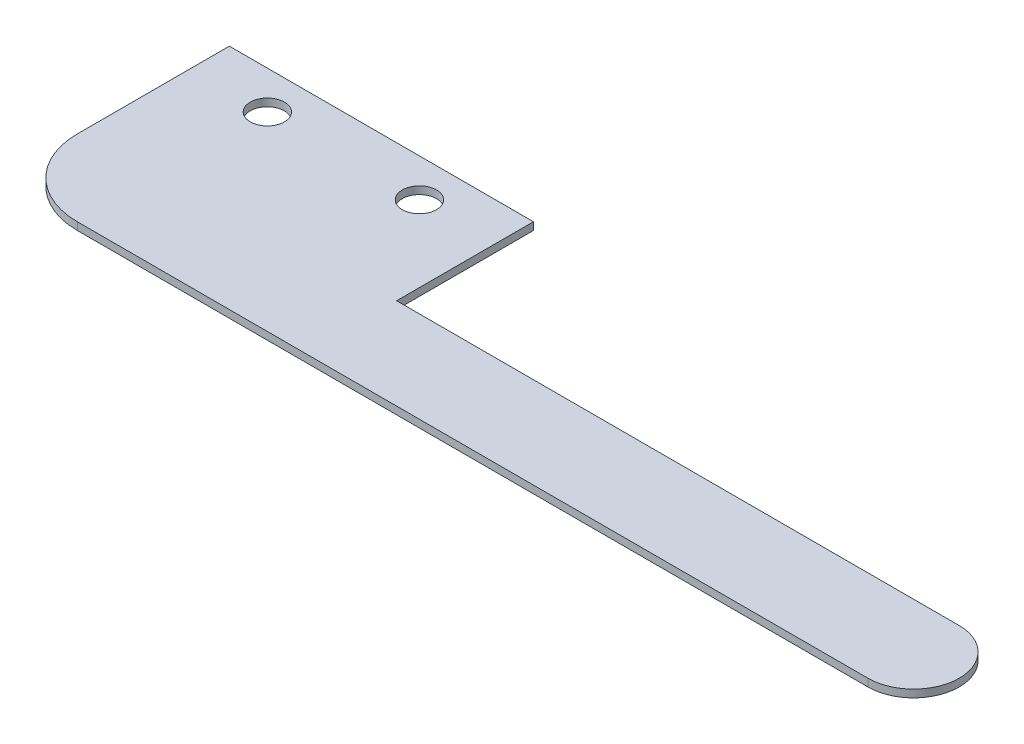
SolidWorks part; units mm, degrees
ref_plane "Front Plane" through (0, 0, 0) normal (0, 0, 1) x (1, 0, 0)
ref_plane "Top Plane" through (0, 0, 0) normal (0, 1, 0) x (1, 0, 0)
ref_plane "Right Plane" through (0, 0, 0) normal (1, 0, 0) x (0, 0, -1)
sketch "Sketch1" plane through (0, 0, 0) normal (0, 1, 0) x (1, 0, 0)
  line L2 (0, 10) -> (0, 30)
  line L3 (0, 30) -> (40, 30)
  line L4 (40, 12) -> (40, 30)
  line L5 (40, 12) -> (114, 12)
  line L7 (10, 0) -> (114, 0)
  arc A0 (114, 0) -> (114, 12) centre (114, 6) ccw
  circle A1 centre (10, 25) radius 2.25
  circle A2 centre (30, 25) radius 2.25
  arc A3 (10, 0) -> (0, 10) centre (10, 10) cw
  point P14 (0, 0)
  dimension "D1" = 6
  dimension "D2" = 74
  dimension "D6" = 4.5
  dimension "D7" = 4.5
  dimension "D8" = 5
  dimension "D9" = 5
  dimension "D10" = 10
  dimension "D11" = 10
  dimension "D12" = 10
  dimension "D3" = 40
  dimension "D4" = 6
  dimension "D5" = 18
extrude "Extrude1" add sketch "Sketch1" along normal blind 1
